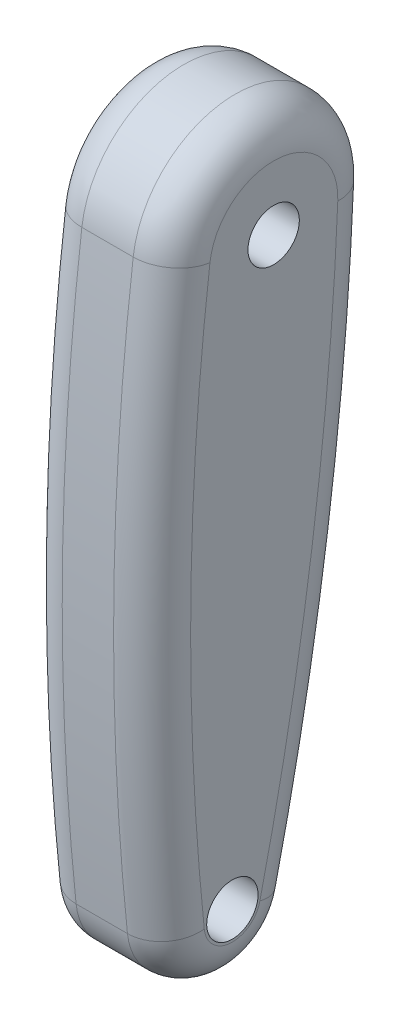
SolidWorks part; units mm, degrees
ref_plane "XY" through (0, 0, 0) normal (0, 0, 1) x (1, 0, 0)
ref_plane "YZ" through (0, 0, 0) normal (0, 1, 0) x (1, 0, 0)
ref_plane "XZ" through (0, 0, 0) normal (1, 0, 0) x (0, 0, -1)
ref_plane "Arm-plane" through (254, 0, 0) normal (1, 0, 0) x (0, 0, -1)
sketch "Sketch5" plane through (254, 0, 0) normal (-1, 0, 0) x (0, 0, 1)
  line L0 (-20.081, -363.1483) -> (-40.4939, -84.495) construction
  arc A0 (9.9184, -78.2306) -> (-91.2484, -86.6439) centre (-40.4939, -84.495) ccw
  arc A1 (-52.2259, -370.6996) -> (12.7609, -366.5734) centre (-20.081, -363.1483) ccw
  arc A2 (12.7609, -366.5734) -> (9.9184, -78.2306) centre (-1250.3885, -234.8403) ccw
  arc A3 (-91.2484, -86.6439) -> (-52.2259, -370.6996) centre (1431.3875, -22.1782) ccw
  dimension "D3" = 1524
  dimension "D4" = 1270
  dimension "D5" = 50.8
  dimension "D6" = 33.02
  dimension "D1" = 279.4
extrude "Base-Extrude" add sketch "Sketch5" along normal mid plane 63.5
fillet "Fillet1" radius 19.05
sketch "Sketch6" plane through (285.75, 0, 0) normal (1, 0, 0) x (0, 0, -1)
  circle A0 centre (40.4939, -84.495) radius 12.7
  circle A1 centre (20.081, -363.1483) radius 12.7
  arc A2 (-12.7609, -366.5734) -> (52.2259, -370.6996) centre (20.081, -363.1483) ccw construction
  arc A3 (91.2484, -86.6439) -> (-9.9184, -78.2306) centre (40.4939, -84.495) ccw construction
  dimension "D1" = 25.4
extrude "Cut-Extrude1" cut sketch "Sketch6" against normal through all
